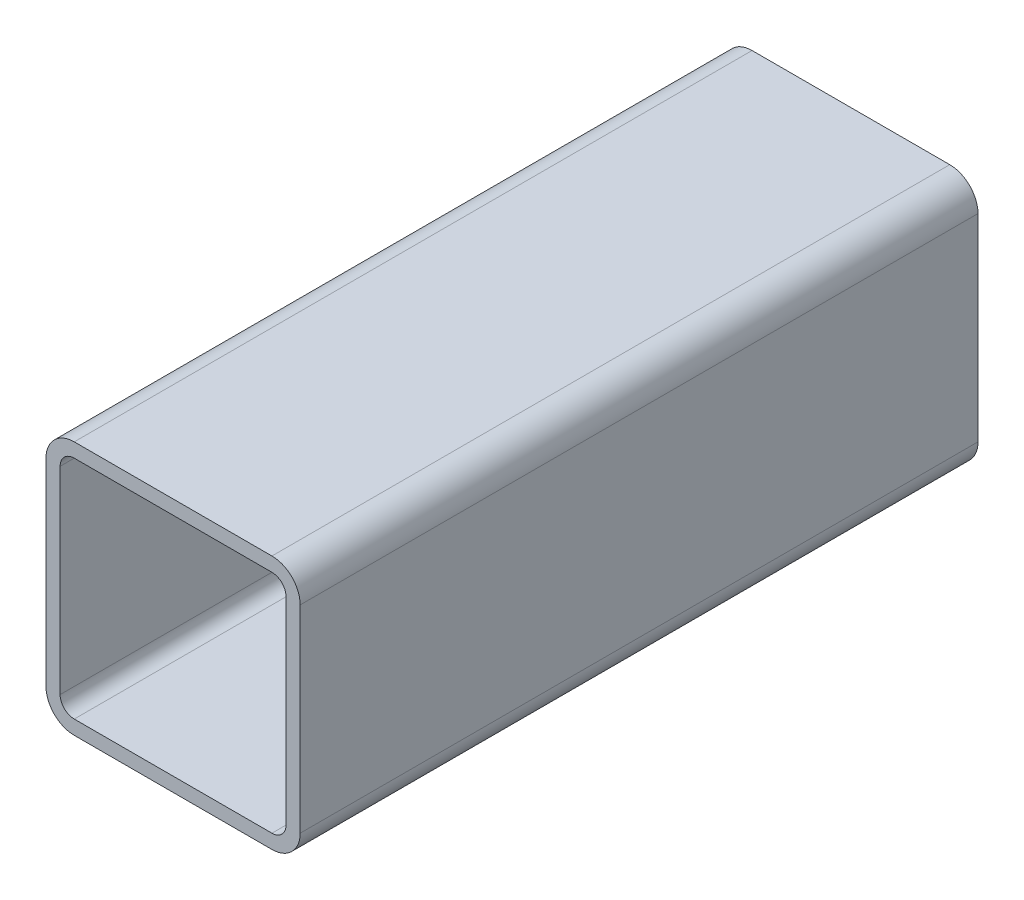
SolidWorks part; units mm, degrees
ref_plane "Front Plane" through (0, 0, 0) normal (0, 0, 1) x (1, 0, 0)
ref_plane "Top Plane" through (0, 0, 0) normal (0, 1, 0) x (1, 0, 0)
ref_plane "Right Plane" through (0, 0, 0) normal (1, 0, 0) x (0, 0, -1)
sketch "Sketch1" plane through (0, 0, 0) normal (0, 0, 1) x (1, 0, 0)
sketch_block_instance "HSS4.5x4.5x0.250-1"
sketch_block "HSS4.5x4.5x0.250"
extrude "Boss-Extrude1" add sketch "Sketch1" along normal blind 304.8
